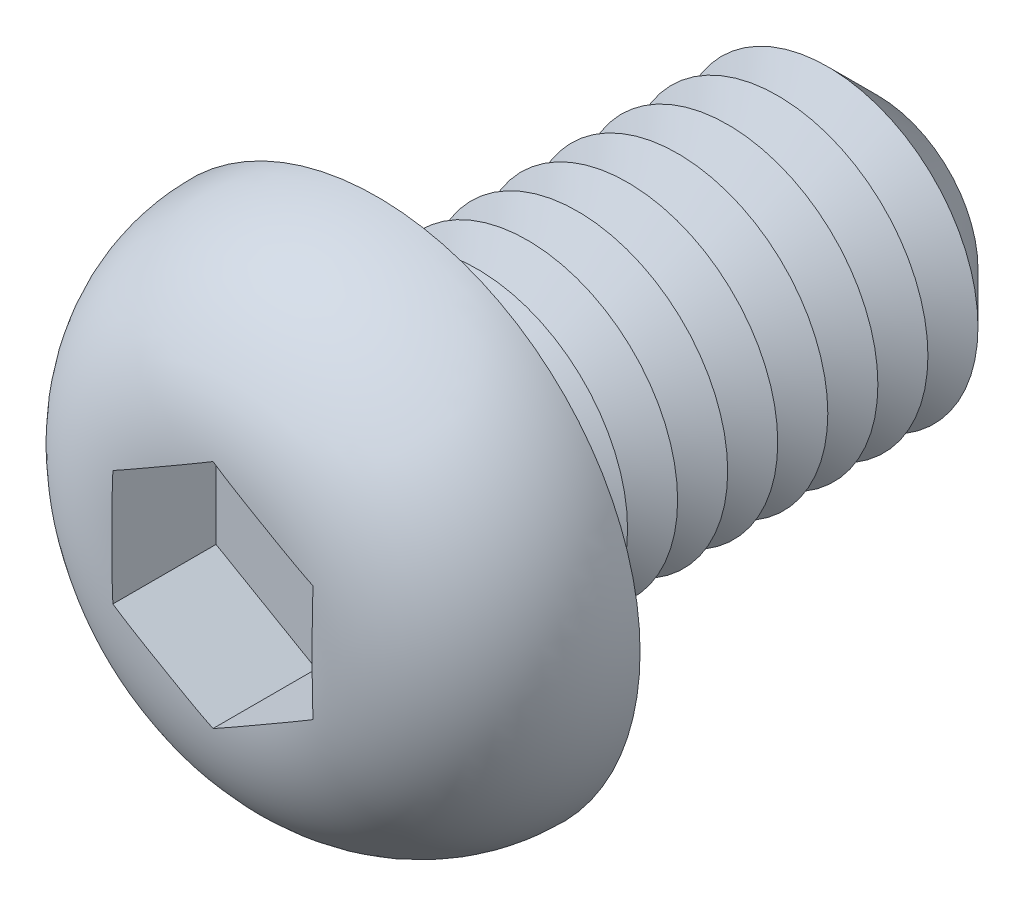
SolidWorks part; units mm, degrees
ref_plane "Front Plane" through (0, 0, 0) normal (0, 0, 1) x (1, 0, 0)
ref_plane "Top Plane" through (0, 0, 0) normal (0, 1, 0) x (1, 0, 0)
ref_plane "Right Plane" through (0, 0, 0) normal (1, 0, 0) x (0, 0, -1)
sketch "Sketch1" plane through (0, 0, 0) normal (1, 0, 0) x (0, 0, -1)
  line L0 (-47.9342, 0) -> (60.3146, 0) construction
sketch "Sketch2" plane through (0, 0, 0) normal (1, 0, 0) x (0, 0, -1)
  line L0 (0, 0) -> (-3.3, 0)
  line L1 (-47.9342, 0) -> (60.3146, 0) construction
  line L2 (-3.3, 0) -> (-3.3, 1.95)
  line L3 (0, 5.25) -> (0, 0)
  arc A0 (-3.3, 1.95) -> (0, 5.25) centre (0, 1.95) cw
  dimension "D1" = 3.3
  dimension "D2" = 3.3
  dimension "D3" = 5.25
revolve "Revolve1" add sketch "Sketch2" angle 360 about L0
sketch "Sketch3" plane through (0, 0, 3.3) normal (0, 0, 1) x (1, 0, 0)
  line L1 (0, 2.3094) -> (-2, 1.1547)
  line L2 (-2, 1.1547) -> (-2, -1.1547)
  line L3 (-2, -1.1547) -> (0, -2.3094)
  line L4 (0, -2.3094) -> (2, -1.1547)
  line L5 (2, -1.1547) -> (2, 1.1547)
  line L6 (2, 1.1547) -> (0, 2.3094)
  circle A0 centre (0, 0) radius 2 construction
  dimension "D1" = 4
extrude "Cut-Extrude1" cut sketch "Sketch3" against normal blind 2.08
sketch "Sketch4" plane through (0, 0, 0) normal (0, 0, -1) x (-1, 0, 0)
  circle A0 centre (0, 0) radius 3
  dimension "D1" = 6
extrude "Boss-Extrude1" add sketch "Sketch4" along normal blind 10
chamfer "Chamfer1" distance 1 angle 45 1 edges at (-3, 0, -10)
sketch "Sketch5" plane through (0, 0, 0) normal (1, 0, 0) x (0, 0, -1)
  line L0 (1, 3) -> (2, 3)
  line L1 (9, 3) -> (0, 3) construction
  line L2 (2, 3) -> (1.5, 2.134)
  line L3 (1.5, 2.134) -> (1, 3)
  line L4 (0, -5.25) -> (0, 5.25) construction
  line L5 (9, 3) -> (0, 3) construction
  dimension "D1" = 1
  dimension "D2" = 1
revolve "Cut-Revolve1" cut sketch "Sketch5" angle 360 about L0
pattern_linear "LPattern1" count 8 spacing 1 along (0, 0, -1) of "Cut-Revolve1"
fillet "Fillet2" radius 0.5 1 edges at (3, 0, 0)
sketch "Sketch6" plane through (0, 0, 1.22) normal (0, 0, 1) x (1, 0, 0)
  circle A0 centre (0, 0) radius 0.8
  dimension "D1" = 1.6
extrude "Cut-Extrude2" cut sketch "Sketch6" against normal up to surface (11.22 mm away)
